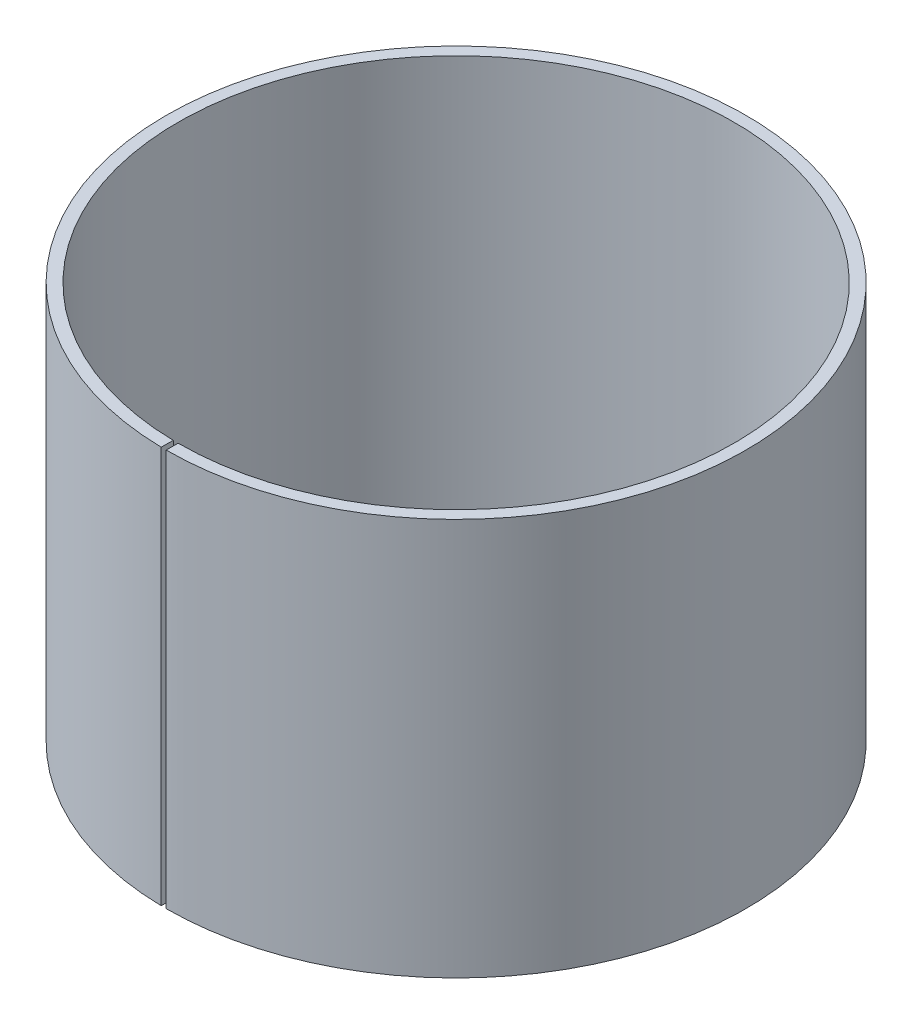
SolidWorks part; units mm, degrees
ref_plane "Front Plane" through (0, 0, 0) normal (0, 0, 1) x (1, 0, 0)
ref_plane "Top Plane" through (0, 0, 0) normal (0, 1, 0) x (1, 0, 0)
ref_plane "Right Plane" through (0, 0, 0) normal (1, 0, 0) x (0, 0, -1)
sketch "Sketch1" plane through (0, 0, 0) normal (0, 1, 0) x (1, 0, 0)
  line L0 (0, 0) -> (0, -36.5) construction
  line L1 (0, 0) -> (-0.637, -36.4944) construction
  arc A0 (0, -36.5) -> (-0.637, -36.4944) centre (0, 0) ccw
  dimension "D1" = 73
  dimension "D2" = 1
extrude "Extrude-Thin1" add sketch "Sketch1" along normal blind 50 thin
